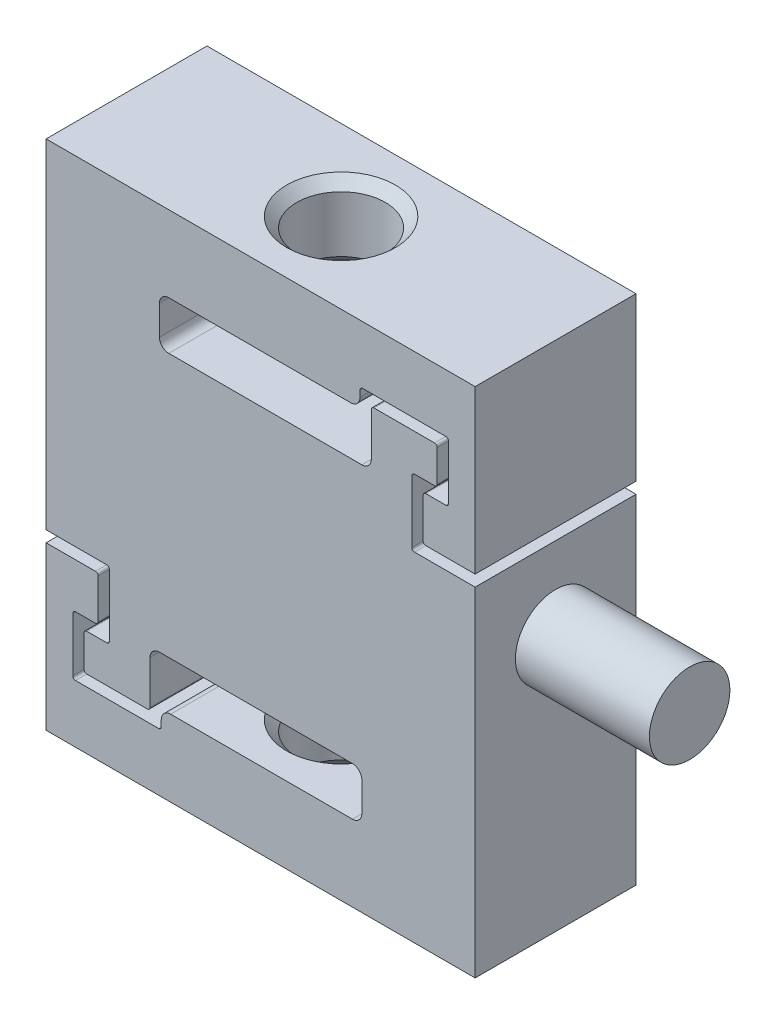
SolidWorks part; units mm, degrees
ref_plane "Front" through (0, 0, 0) normal (0, 0, 1) x (1, 0, 0)
ref_plane "Top" through (0, 0, 0) normal (0, 1, 0) x (1, 0, 0)
ref_plane "Right" through (0, 0, 0) normal (1, 0, 0) x (0, 0, -1)
sketch "Sketch1" plane through (0, 0, 0) normal (0, 0, 1) x (1, 0, 0)
  line L0 (-8, 9.55) -> (8, 9.55)
  line L1 (8, 9.55) -> (8, 3.4943)
  line L2 (8, 3.0743) -> (5.7401, 3.0743)
  line L3 (5.6401, 3.1743) -> (5.6401, 5.4935)
  line L4 (5.7401, 5.5935) -> (6.4848, 5.5935)
  line L5 (6.5848, 5.6935) -> (6.5848, 6.8737)
  line L6 (6.4848, 6.9737) -> (4.2263, 6.9737)
  line L7 (4.1263, 6.8737) -> (4.1263, 5.2619)
  line L8 (3.7763, 4.9119) -> (-3.4236, 4.9119)
  line L9 (-3.7736, 5.2619) -> (-3.7736, 6.3582)
  line L10 (8, -9.55) -> (-8, -9.55)
  line L11 (-8, 9.55) -> (-8, -3.0743)
  line L12 (8, 9.55) -> (-8, -9.55) construction
  line L13 (8, 3.4943) -> (6.1601, 3.4943)
  line L14 (6.0601, 3.5943) -> (6.0601, 5.0735)
  line L15 (6.1601, 5.1735) -> (6.9048, 5.1735)
  line L16 (7.0048, 5.2735) -> (7.0048, 7.2937)
  line L17 (6.9048, 7.3937) -> (3.8063, 7.3937)
  line L18 (3.7063, 7.2937) -> (3.7063, 7.0582)
  line L19 (8, 3.0743) -> (8, -9.55)
  line L20 (-3.4236, 6.7082) -> (3.3563, 6.7082)
  line L21 (-10.3466, 0) -> (10.8332, 0) construction
  line L22 (0, 10.4555) -> (0, -10.1212) construction
  line L23 (-8, -3.0743) -> (-5.7401, -3.0743)
  line L24 (-5.6401, -3.1743) -> (-5.6401, -5.4935)
  line L25 (-5.7401, -5.5935) -> (-6.4848, -5.5935)
  line L26 (-6.5848, -5.6935) -> (-6.5848, -6.8737)
  line L27 (-6.4848, -6.9737) -> (-4.2263, -6.9737)
  line L28 (-4.1263, -6.8737) -> (-4.1263, -5.2619)
  line L29 (-3.7763, -4.9119) -> (3.4236, -4.9119)
  line L30 (3.7736, -5.2619) -> (3.7736, -6.3582)
  line L31 (-8, -3.4943) -> (-6.1601, -3.4943)
  line L32 (-6.0601, -3.5943) -> (-6.0601, -5.0735)
  line L33 (-6.1601, -5.1735) -> (-6.9048, -5.1735)
  line L34 (-7.0048, -5.2735) -> (-7.0048, -7.2937)
  line L35 (-6.9048, -7.3937) -> (-3.8063, -7.3937)
  line L36 (-3.7063, -7.2937) -> (-3.7063, -7.0582)
  line L37 (3.4236, -6.7082) -> (-3.3563, -6.7082)
  line L38 (-8, -3.4943) -> (-8, -9.55)
  arc A0 (3.3563, 6.7082) -> (3.7063, 7.0582) centre (3.3563, 7.0582) ccw
  arc A1 (4.1263, 5.2619) -> (3.7763, 4.9119) centre (3.7763, 5.2619) cw
  arc A2 (-3.7736, 6.3582) -> (-3.4236, 6.7082) centre (-3.4236, 6.3582) cw
  arc A3 (-3.4236, 4.9119) -> (-3.7736, 5.2619) centre (-3.4236, 5.2619) cw
  arc A4 (5.7401, 3.0743) -> (5.6401, 3.1743) centre (5.7401, 3.1743) cw
  arc A5 (6.1601, 3.4943) -> (6.0601, 3.5943) centre (6.1601, 3.5943) cw
  arc A6 (6.0601, 5.0735) -> (6.1601, 5.1735) centre (6.1601, 5.0735) cw
  arc A7 (5.6401, 5.4935) -> (5.7401, 5.5935) centre (5.7401, 5.4935) cw
  arc A8 (6.4848, 5.5935) -> (6.5848, 5.6935) centre (6.4848, 5.6935) ccw
  arc A9 (6.9048, 5.1735) -> (7.0048, 5.2735) centre (6.9048, 5.2735) ccw
  arc A10 (7.0048, 7.2937) -> (6.9048, 7.3937) centre (6.9048, 7.2937) ccw
  arc A11 (6.5848, 6.8737) -> (6.4848, 6.9737) centre (6.4848, 6.8737) ccw
  arc A12 (3.8063, 7.3937) -> (3.7063, 7.2937) centre (3.8063, 7.2937) ccw
  arc A13 (4.2263, 6.9737) -> (4.1263, 6.8737) centre (4.2263, 6.8737) ccw
  circle A14 centre (0, 0) radius 14.1483 construction
  arc A15 (-3.3563, -6.7082) -> (-3.7063, -7.0582) centre (-3.3563, -7.0582) ccw
  arc A16 (-4.1263, -5.2619) -> (-3.7763, -4.9119) centre (-3.7763, -5.2619) cw
  arc A17 (3.7736, -6.3582) -> (3.4236, -6.7082) centre (3.4236, -6.3582) cw
  arc A18 (3.4236, -4.9119) -> (3.7736, -5.2619) centre (3.4236, -5.2619) cw
  arc A19 (-5.7401, -3.0743) -> (-5.6401, -3.1743) centre (-5.7401, -3.1743) cw
  arc A20 (-6.1601, -3.4943) -> (-6.0601, -3.5943) centre (-6.1601, -3.5943) cw
  arc A21 (-6.0601, -5.0735) -> (-6.1601, -5.1735) centre (-6.1601, -5.0735) cw
  arc A22 (-5.6401, -5.4935) -> (-5.7401, -5.5935) centre (-5.7401, -5.4935) cw
  arc A23 (-6.4848, -5.5935) -> (-6.5848, -5.6935) centre (-6.4848, -5.6935) ccw
  arc A24 (-6.9048, -5.1735) -> (-7.0048, -5.2735) centre (-6.9048, -5.2735) ccw
  arc A25 (-7.0048, -7.2937) -> (-6.9048, -7.3937) centre (-6.9048, -7.2937) ccw
  arc A26 (-6.5848, -6.8737) -> (-6.4848, -6.9737) centre (-6.4848, -6.8737) ccw
  arc A27 (-3.8063, -7.3937) -> (-3.7063, -7.2937) centre (-3.8063, -7.2937) ccw
  arc A28 (-4.2263, -6.9737) -> (-4.1263, -6.8737) centre (-4.2263, -6.8737) ccw
  point P189 (0, 0)
  dimension "D1" = 0.35
  dimension "D2" = 0.1
  dimension "D3" = 2
extrude "Boss-Extrude1" add sketch "Sketch1" along normal blind 6
sketch "Sketch3" plane through (8, 0, 0) normal (1, 0, 0) x (0, 0, -1)
  circle A0 centre (-3, 0) radius 1.5
  dimension "D1" = 3
extrude "Boss-Extrude2" add sketch "Sketch3" along normal blind 5
hole_wizard "M4x0.7 Tapped Hole1" positions "Sketch5" profile "Sketch6" tap size "M4x0.7" standard "ANSI Metric"
sketch "Sketch5" plane through (0, 9.55, 0) normal (0, 1, 0) x (1, 0, 0)
  point P0 (0, -3)
sketch "Sketch6" plane through (0, 9.55, 3) normal (1, 0, 0) x (0, 0, 1)
  line L0 (0, 0) -> (0, 14.4619)
  line L1 (0, 14.4619) -> (2.025, 14.4619)
  line L2 (1.65, 14.0869) -> (1.65, 0.375)
  line L3 (1.65, 0.375) -> (2.025, 0)
  line L5 (2.025, 0) -> (0, 0)
  line L6 (-1.65, 0.375) -> (-2.025, 0) construction
  line L7 (2.025, 14.4619) -> (1.65, 14.0869)
  line L8 (-2.025, 14.4619) -> (-1.65, 14.0869) construction
  line L11 (0, -6.35) -> (0, 107.95) construction
  dimension "Thru Tap Drill Dia." = 3.3
  dimension "Thru Tap Drill Depth" = 14.4619
  dimension "Near C'Sink Dia." = 4.05
  dimension "Near C'Sink Angle" = 90
  dimension "Far C'Sink Dia." = 4.05
  dimension "Far C'Sink Angle" = 90
mirror "Mirror1" about plane through (0, 0, 0) normal (0, 1, 0) of "M4x0.7 Tapped Hole1"
